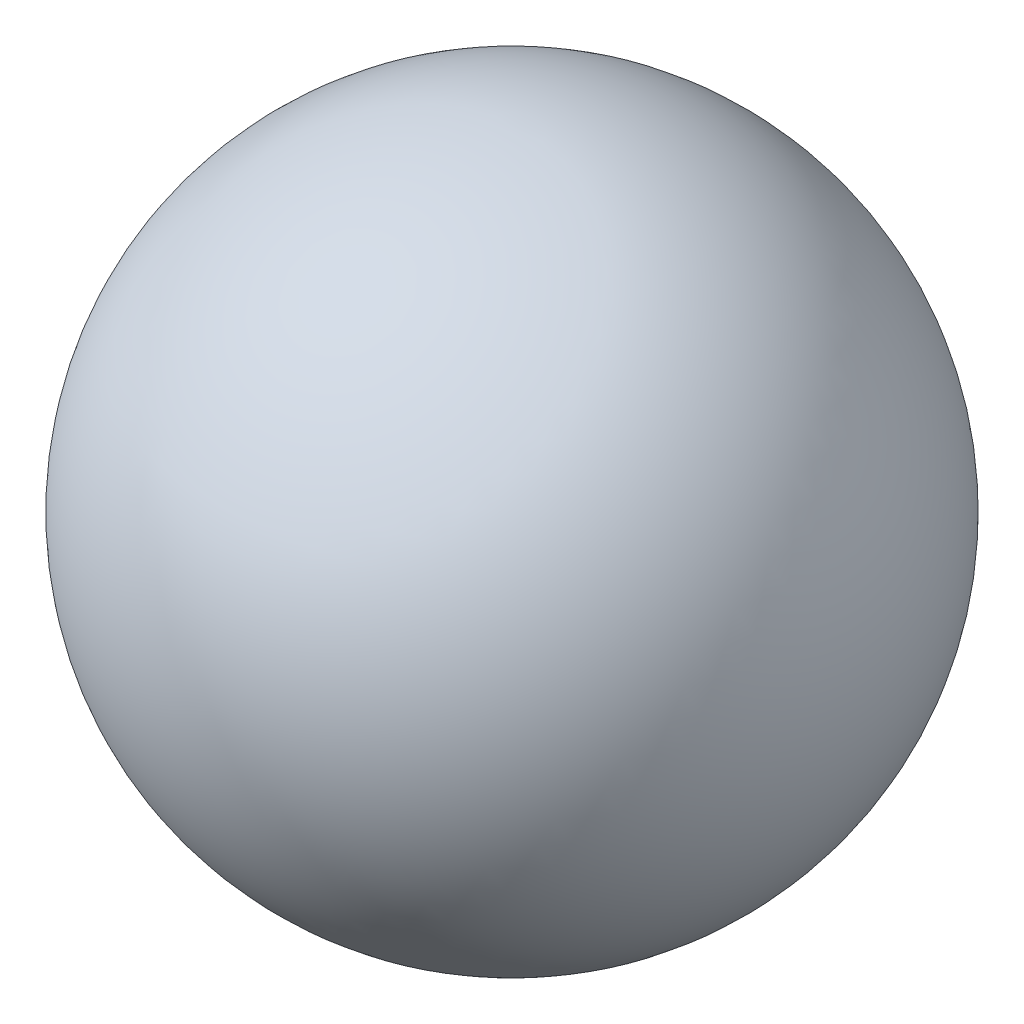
SolidWorks part; units mm, degrees
ref_plane "Front" through (0, 0, 0) normal (0, 0, 1) x (1, 0, 0)
ref_plane "Top" through (0, 0, 0) normal (0, 1, 0) x (1, 0, 0)
ref_plane "Right" through (0, 0, 0) normal (1, 0, 0) x (0, 0, -1)
sketch "Sketch1" plane through (0, 0, 0) normal (0, 0, 1) x (1, 0, 0)
  line L0 (0, -6.39) -> (0, 6.39)
  arc A0 (0, 6.39) -> (0, -6.39) centre (0, 0) cw
  dimension "D1" = 6.39
revolve "Revolve1" add sketch "Sketch1" angle 360 about L0
equation "\"A\"= 10"
equation "\"B\"= 10"
equation "\"C\"= 10"
